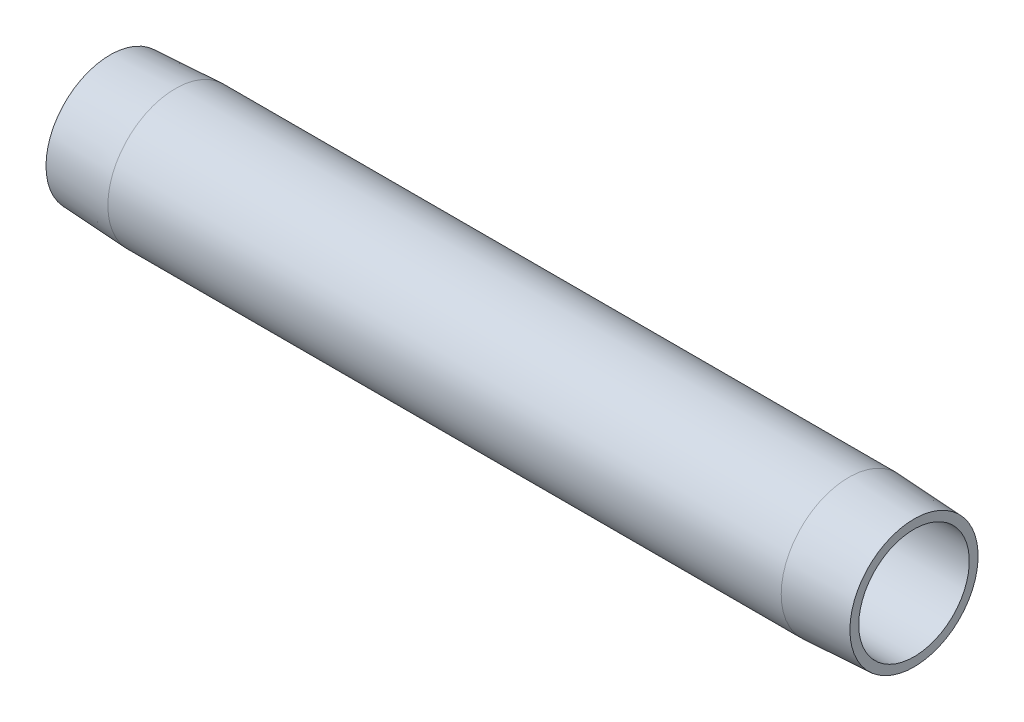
SolidWorks part; units mm, degrees
ref_plane "Front Plane" through (0, 0, 0) normal (0, 0, 1) x (1, 0, 0)
ref_plane "Top Plane" through (0, 0, 0) normal (0, 1, 0) x (1, 0, 0)
ref_plane "Right Plane" through (0, 0, 0) normal (1, 0, 0) x (0, 0, -1)
sketch "Sketch1" plane through (0, 0, 0) normal (0, 0, 1) x (1, 0, 0)
  line L6 (127, 8.7313) -> (0, 8.7313)
  line L7 (10.3124, 10.668) -> (0, 10.1276)
  line L8 (116.6876, 10.668) -> (10.3124, 10.668)
  line L9 (127, 10.1276) -> (116.6876, 10.668)
  line L10 (127, 8.7313) -> (127, 10.1276)
  line L11 (0, 10.1276) -> (0, 8.7313)
  line L12 (0, 0) -> (50000, 0) construction
  line L13 (0, -55) -> (0, 55) construction
  dimension "D1" = 127
  dimension "D2" = 3
  dimension "D3" = 3
  dimension "D4" = 21.336
  dimension "D5" = 17.4625
  dimension "D6" = 10.3124
  dimension "D7" = 10.3124
revolve "Revolve1" add sketch "Sketch1" angle 360 about L12
